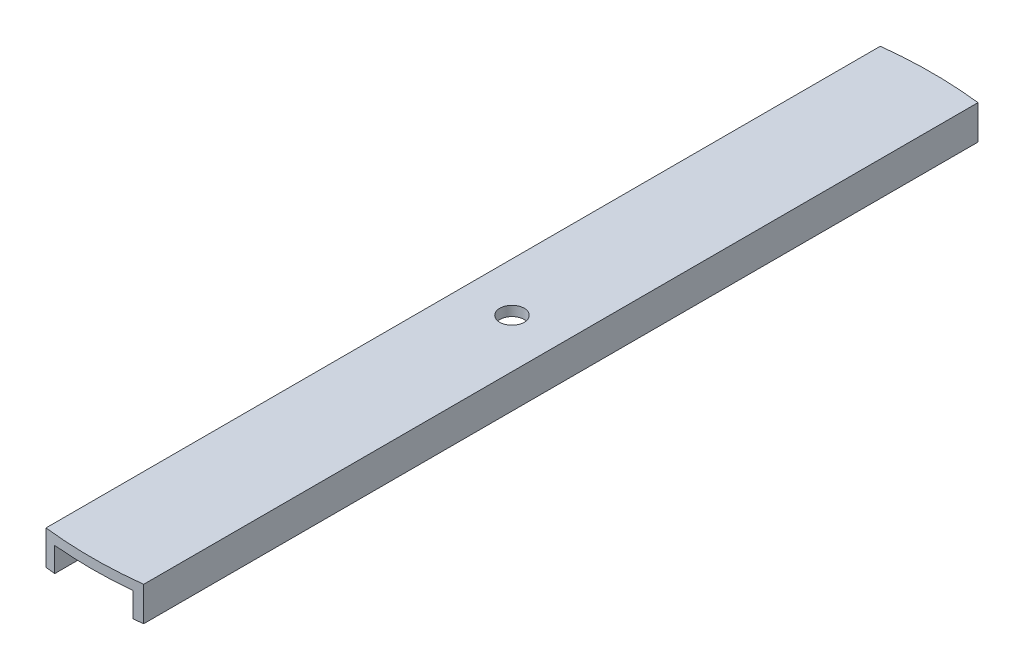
SolidWorks part; units mm, degrees
ref_plane "Plan de face" through (0, 0, 0) normal (0, 0, 1) x (1, 0, 0)
ref_plane "Plan de dessus" through (0, 0, 0) normal (0, 1, 0) x (1, 0, 0)
ref_plane "Plan de droite" through (0, 0, 0) normal (1, 0, 0) x (0, 0, -1)
sketch "Esquisse1" plane through (0, 0, 0) normal (0, 0, 1) x (1, 0, 0)
  line L0 (-8, 0) -> (8, 0)
  line L1 (8, 0) -> (8, -5)
  line L2 (-8, 0) -> (-8, -5)
  dimension "D1" = 16
  dimension "D2" = 8
  dimension "D3" = 5
extrude "Extru.-Mince1" add sketch "Esquisse1" along normal mid plane 200 thin
sketch "Esquisse2" plane through (0, 0, 0) normal (0, -1, 0) x (1, 0, 0)
  circle A0 centre (0, 0) radius 2.5
  dimension "D1" = 5
extrude "Enlèv. mat.-Extru.1" cut sketch "Esquisse2" against normal blind 10
sketch "Esquisse3" plane through (0, 2, 0) normal (0, 1, 0) x (1, 0, 0)
  circle A0 centre (0, 0) radius 86
  dimension "D1" = 172
extrude "Enlèv. mat.-Extru.2" cut sketch "Esquisse3" against normal blind 10 flip side to cut
